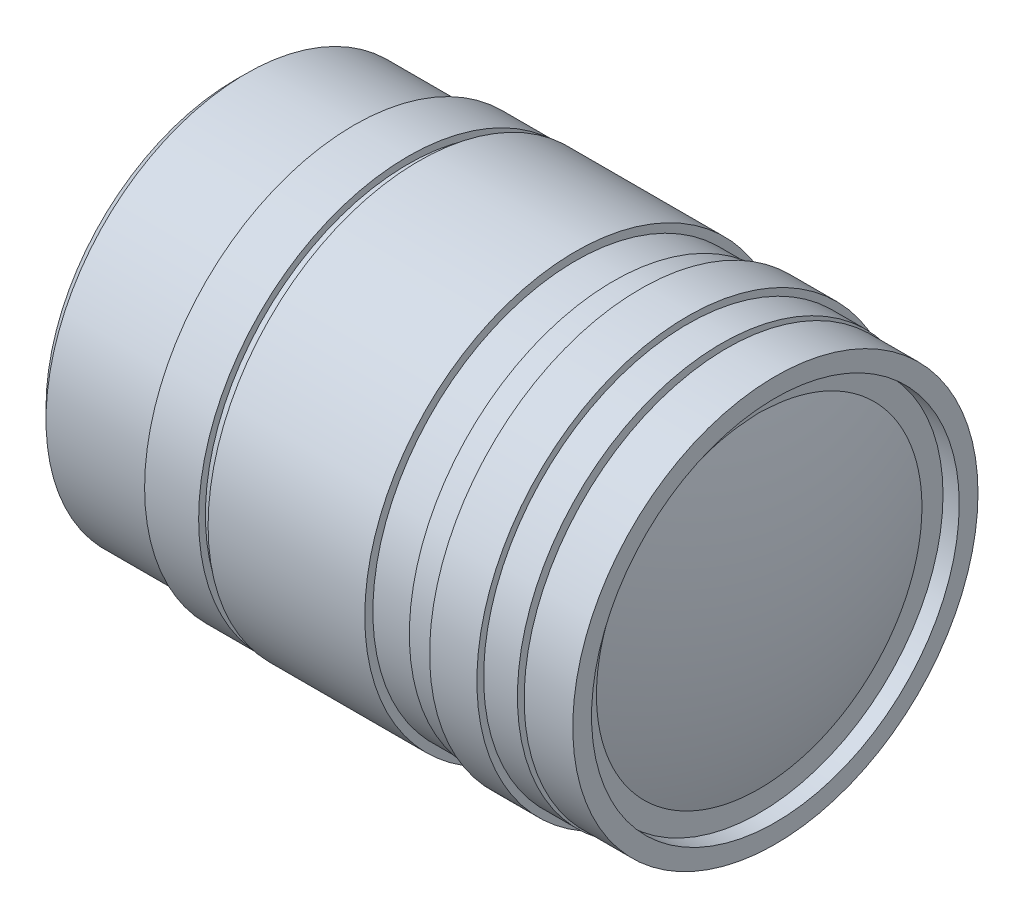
SolidWorks part; units mm, degrees
ref_plane "Front Plane" through (0, 0, 0) normal (0, 0, 1) x (1, 0, 0)
ref_plane "Top Plane" through (0, 0, 0) normal (0, 1, 0) x (1, 0, 0)
ref_plane "Right Plane" through (0, 0, 0) normal (1, 0, 0) x (0, 0, -1)
sketch "Sketch1" plane through (0, 0, 0) normal (1, 0, 0) x (0, 0, -1)
  circle A0 centre (0, 0) radius 37
extrude "Boss-Extrude1" add sketch "Sketch1" along normal blind 22
sketch "Sketch2" plane through (22, 0, 0) normal (1, 0, 0) x (0, 0, -1)
  circle A0 centre (0, 0) radius 38.75
extrude "Boss-Extrude2" add sketch "Sketch2" along normal blind 10
sketch "Sketch3" plane through (32, 0, 0) normal (1, 0, 0) x (0, 0, -1)
  circle A0 centre (0, 0) radius 37.5
extrude "Boss-Extrude3" add sketch "Sketch3" along normal blind 38
sketch "Sketch4" plane through (0, 0, 0) normal (1, 0, 0) x (0, 0, -1)
  circle A0 centre (0, 0) radius 39
extrude "Boss-Extrude4" add sketch "Sketch4" along normal blind 29 from offset 34 separate body
sketch "Sketch7" plane through (0, 0, 0) normal (1, 0, 0) x (0, 0, -1)
  circle A0 centre (0, 0) radius 37.75
extrude "Boss-Extrude6" add sketch "Sketch7" along normal blind 20 from offset 70
sketch "Sketch5" plane through (0, 0, 0) normal (1, 0, 0) x (0, 0, -1)
  circle A0 centre (0, 0) radius 39
  dimension "D1" = 78
extrude "Boss-Extrude5" add sketch "Sketch5" along normal blind 8.75 from offset 75 separate body
sketch "Sketch8" plane through (90, 0, 0) normal (1, 0, 0) x (0, 0, -1)
  circle A0 centre (0, 0) radius 35
extrude "Boss-Extrude7" add sketch "Sketch8" along normal blind 3
sketch "Sketch10" plane through (0, 0, 0) normal (1, 0, 0) x (0, 0, -1)
  circle A0 centre (0, 0) radius 37.5
extrude "Boss-Extrude8" add sketch "Sketch10" along normal blind 9 from offset 91
chamfer "Chamfer1" distance 2 angle 45 1 edges at (0, 0, -37)
sketch "Sketch11" plane through (100, 0, 0) normal (1, 0, 0) x (0, 0, -1)
  circle A0 centre (0, 0) radius 34.0268
extrude "Cut-Extrude1" cut sketch "Sketch11" against normal blind 3
sketch "Sketch12" plane through (0, 0, 0) normal (0, 0, 1) x (1, 0, 0)
  line L0 (0, 0) -> (101.5843, 0.5449) construction
  line L1 (95.0225, 35.9222) -> (92.3615, 35.9222)
  line L2 (92.3615, 35.9222) -> (92.3615, 0.4954)
  line L3 (101.5843, 0.5449) -> (92.3615, 0.4954)
  arc A0 (95.0225, 35.9222) -> (101.5843, 0.5449) centre (0, 0) cw
revolve "Revolve2" add sketch "Sketch12" angle 360 about L0
